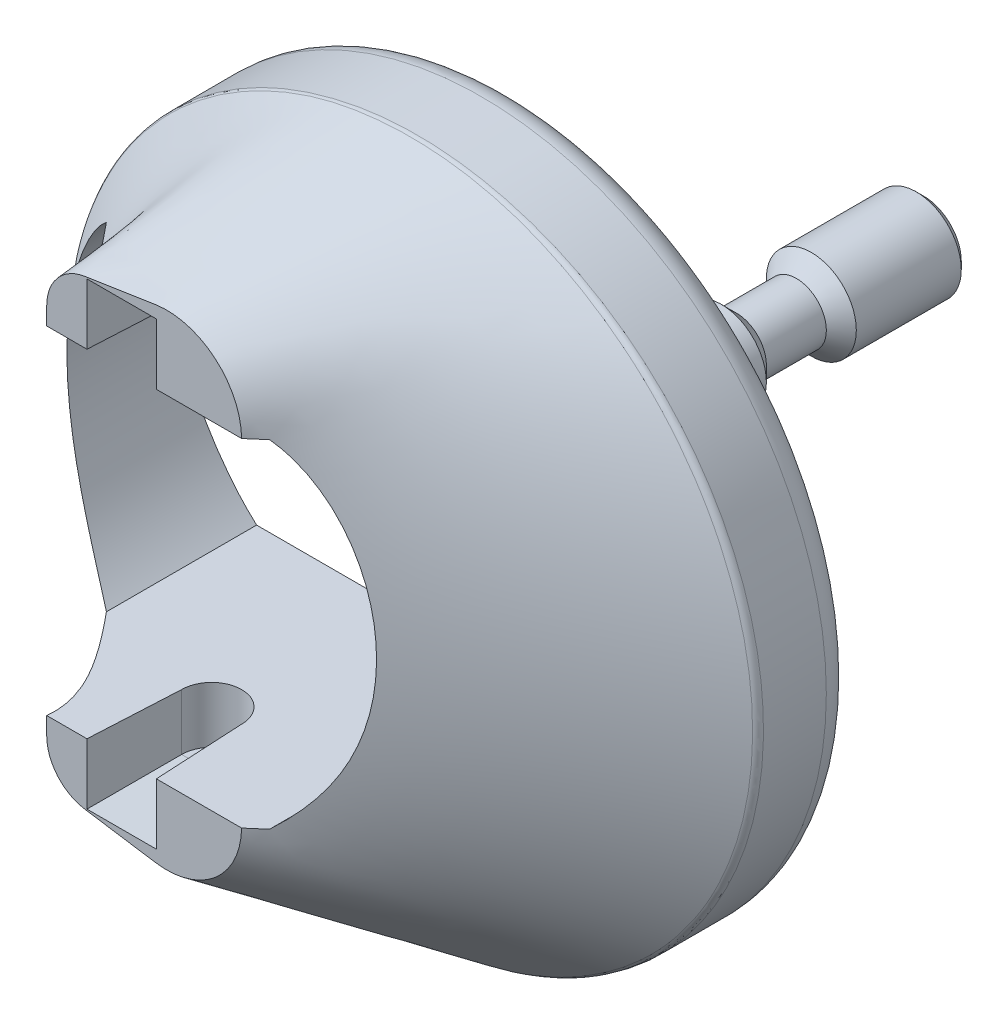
SolidWorks part; units mm, degrees
ref_plane "Plan de face" through (0, 0, 0) normal (0, 0, 1) x (1, 0, 0)
ref_plane "Plan de dessus" through (0, 0, 0) normal (0, 1, 0) x (1, 0, 0)
ref_plane "Plan de droite" through (0, 0, 0) normal (1, 0, 0) x (0, 0, -1)
sketch "Esquisse1" plane through (0, 0, 0) normal (0, 0, 1) x (1, 0, 0)
  circle A0 centre (0, 0) radius 23
  dimension "D1" = 46
extrude "Extrusion1" add sketch "Esquisse1" along normal blind 6.5
ref_plane "Plan1" through (0, 0, 18) normal (0, 0, 1) x (1, 0, 0)
sketch "Esquisse2" plane through (0, 0, 18) normal (0, 0, 1) x (1, 0, 0)
  line L0 (-31.9579, 0) -> (37.7774, 0) construction
  line L1 (-13, -12.4262) -> (-13, 12.4262)
  line L2 (-10.4562, 15.3914) -> (-5.7603, 16.1138)
  line L3 (0, 11.1719) -> (0, -11.1719)
  line L4 (-10.4562, -15.3914) -> (-5.7603, -16.1138)
  arc A0 (-13, 12.4262) -> (-10.4562, 15.3914) centre (-10, 12.4262) cw
  arc A1 (0, 11.1719) -> (-5.7603, 16.1138) centre (-5, 11.1719) ccw
  arc A2 (0, -11.1719) -> (-5.7603, -16.1138) centre (-5, -11.1719) cw
  arc A3 (-13, -12.4262) -> (-10.4562, -15.3914) centre (-10, -12.4262) ccw
  point P3 (0, -17)
  point P7 (-13, 0)
  point P9 (-13, 15)
  point P12 (0, 17)
  point P19 (0, 0)
  point P20 (-13, -15)
  dimension "D3" = 3
  dimension "D4" = 5
  dimension "D1" = 15
  dimension "D2" = 17
  dimension "D5" = 13
sketch "Esquisse3" plane through (0, 0, 6.5) normal (0, 0, 1) x (1, 0, 0)
  circle A1 centre (0, 0) radius 23
  circle A2 centre (0, 0) radius 23
  dimension "D1" = 0
loft "Lissage1" add profiles "Esquisse3", "Esquisse2"
ref_plane "Plan2" through (0, 0, 12) normal (0, 0, 1) x (1, 0, 0)
sketch "Esquisse4" plane through (0, 0, 12) normal (0, 0, 1) x (1, 0, 0)
  line L0 (-8, 31.3665) -> (-8, -35.3878) construction
  line L1 (-13, 12.4262) -> (-13, -12.4262) construction
  line L2 (-25.088, 0) -> (23, 0) construction
  line L3 (-17, 11.25) -> (1, 11.25)
  line L4 (-17, -11.25) -> (1, -11.25)
  line L5 (6, 17.0972) -> (6, -10.5601) construction
  line L6 (-22, 17.0972) -> (-22, -10.5601) construction
  circle A0 centre (0, 0) radius 23 construction
  arc A1 (1, 11.25) -> (1, -11.25) centre (-9.1562, 0) cw
  arc A2 (-17, 11.25) -> (-17, -11.25) centre (-6.8438, 0) ccw
  point P12 (-8, 11.25)
  point P21 (-8, -11.25)
  dimension "D1" = 5
  dimension "D2" = 11.25
  dimension "D3" = 9
  dimension "D4" = 5
extrude "Enlèv. mat.-Extru.1" cut sketch "Esquisse4" against normal through all and the other way through all
ref_plane "Plan3" through (0, 0, -5) normal (0, 0, -1) x (-1, 0, 0)
sketch "Esquisse5" plane through (0, 0, -5) normal (0, 0, -1) x (-1, 0, 0)
  circle A0 centre (0, 0) radius 6.5
  dimension "D1" = 13
extrude "Extrusion2" add sketch "Esquisse5" against normal up to surface (17 mm away)
sketch "Esquisse6" plane through (0, 0, 12) normal (0, 0, 1) x (1, 0, 0)
  line L0 (-8, 11.25) -> (-8, -11.25) construction
  line L1 (-8, 11.25) -> (-8, -11.25)
  line L2 (1, 11.25) -> (-17, 11.25)
  line L3 (-17, -11.25) -> (1, -11.25)
  line L4 (1, 11.25) -> (-8, 11.25)
  line L5 (-8, -11.25) -> (1, -11.25)
  arc A2 (1, -11.25) -> (1, 11.25) centre (-9.1562, 0) ccw
  arc A3 (-17, 11.25) -> (-17, -11.25) centre (-6.8438, 0) ccw
  arc A4 (1, -11.25) -> (1, 11.25) centre (-9.1562, 0) ccw
  dimension "D2" = 8
  dimension "D1" = 0
revolve "Enlèvement de matière-Révolution2" cut sketch "Esquisse6" angle 360 about L1
sketch "Esquisse7" plane through (0, 0, 12) normal (0, 0, 1) x (1, 0, 0)
  line L0 (-8, -13.3551) -> (-8, 17.803) construction
  line L1 (-8, 11.25) -> (-8, -11.25) construction
  line L2 (-15.2599, 0) -> (11.8242, 0) construction
  line L3 (-10, -15) -> (-10, 15)
  line L4 (-10, 15) -> (-8, 15)
  line L5 (-10, -15) -> (-8, -15)
  line L6 (-8, 15) -> (-8, -15)
  point P12 (-10, 0)
  dimension "D1" = 2
  dimension "D2" = 15
revolve "Enlèvement de matière-Révolution3" cut sketch "Esquisse7" angle 360 about L6
sketch "Esquisse8" plane through (0, 0, 12) normal (0, 0, 1) x (1, 0, 0)
  line L0 (-8, 17.4188) -> (-8, -18.2146) construction
  line L1 (-6, 15) -> (-6, -15)
  line L4 (-10, 15) -> (-10, -15)
  line L5 (-8, 15) -> (-10, 15)
  line L6 (-8, -15) -> (-8, 15)
  line L7 (-10, -15) -> (-8, -15)
  line L8 (-10, 15) -> (-10, -15)
  line L9 (-6, 15) -> (-10, 15)
  line L11 (-10, -15) -> (-6, -15)
  dimension "D1" = 0
extrude "Enlèv. mat.-Extru.2" cut sketch "Esquisse8" along normal through all draft 3
sketch "Esquisse10" plane through (0, 0, 0) normal (1, 0, 0) x (0, 0, -1)
  line L0 (-35.0804, 0) -> (34.6818, 0) construction
  line L1 (5, 0) -> (5, 3)
  line L2 (5, -6.5) -> (5, 6.5) construction
  line L3 (5, 3) -> (14, 3)
  line L4 (14, 3) -> (15, 2)
  line L5 (15, 2) -> (19, 2)
  line L6 (19, 2) -> (20, 3)
  line L7 (20, 3) -> (27, 3)
  line L8 (27, 3) -> (27.5, 2.5)
  line L9 (27.5, 2.5) -> (27.5, 0)
  line L10 (27.5, 0) -> (5, 0)
  dimension "D1" = 7
  dimension "D2" = 135
  dimension "D3" = 9
  dimension "D4" = 4
  dimension "D5" = 135
  dimension "D6" = 2
  dimension "D7" = 3
  dimension "D8" = 0.5
revolve "Révolution1" add sketch "Esquisse10" angle 360 about L0
fillet "Congé1" radius 2 1 edges at (23, 0, 0)
fillet "Congé2" radius 0.5 1 edges at (-9.2457, -21.0598, 6.5005)
